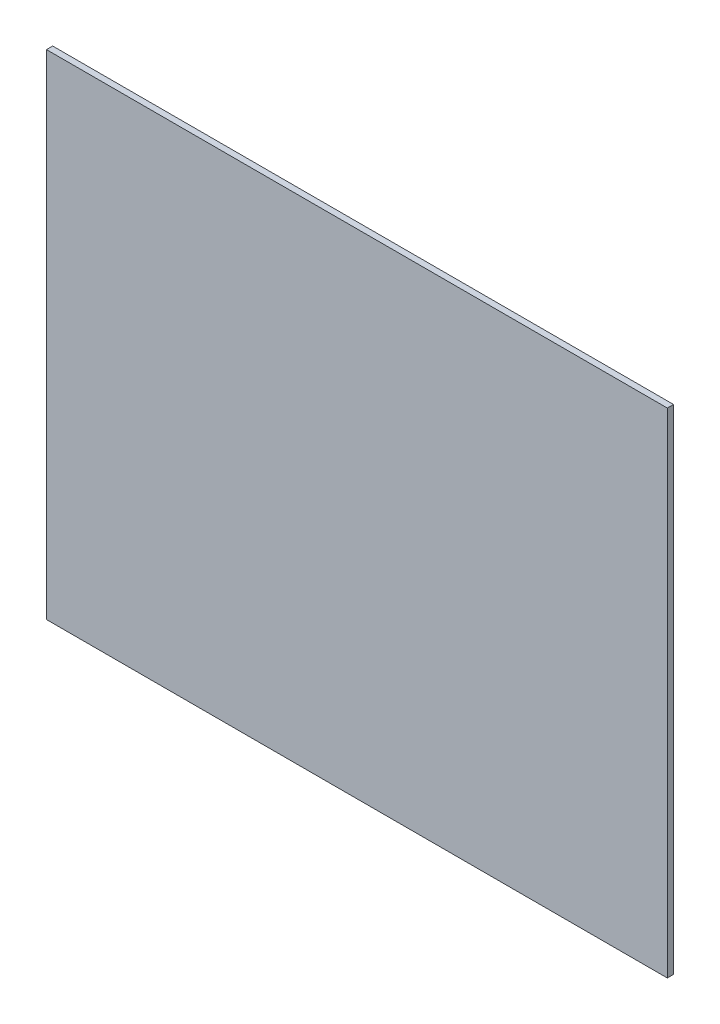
SolidWorks part; units mm, degrees
ref_plane "Plan de face" through (0, 0, 0) normal (0, 0, 1) x (1, 0, 0)
ref_plane "Plan de dessus" through (0, 0, 0) normal (0, 1, 0) x (1, 0, 0)
ref_plane "Plan de droite" through (0, 0, 0) normal (1, 0, 0) x (0, 0, -1)
sketch "Esquisse1" plane through (0, 0, 0) normal (0, 0, 1) x (1, 0, 0)
  line L1 (0, 0) -> (1000, 0)
  line L2 (0, 0) -> (0, 795)
  line L3 (0, 795) -> (1000, 795)
  line L4 (1000, 0) -> (1000, 795)
  dimension "D1" = 795
  dimension "D2" = 1000
extrude "Extrusion1" add sketch "Esquisse1" along normal blind 10
